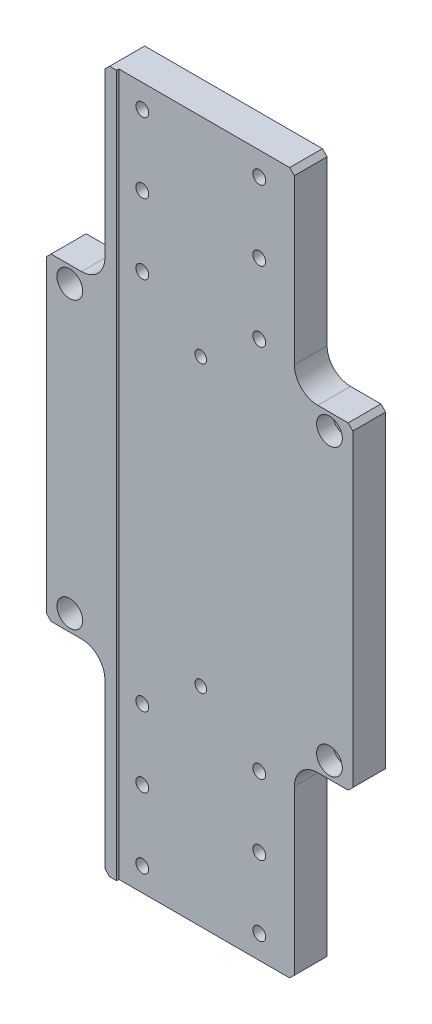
SolidWorks part; units mm, degrees
ref_plane "정면" through (0, 0, 0) normal (0, 0, 1) x (1, 0, 0)
ref_plane "윗면" through (0, 0, 0) normal (0, 1, 0) x (1, 0, 0)
ref_plane "우측면" through (0, 0, 0) normal (1, 0, 0) x (0, 0, -1)
sketch "스케치1" plane through (0, 0, 0) normal (0, 0, 1) x (1, 0, 0)
  line L1 (-65, 68) -> (65, 68)
  line L2 (-65, 68) -> (-65, -68)
  line L3 (-65, -68) -> (65, -68)
  line L4 (65, 68) -> (65, -68)
  line L5 (-40, 150) -> (40, 150)
  line L6 (-40, 150) -> (-40, -150)
  line L7 (-40, -150) -> (40, -150)
  line L8 (40, 150) -> (40, -150)
  line L9 (-40, 150) -> (40, -150) construction
  line L10 (-40, -150) -> (40, 150) construction
  point P4 (0, 0)
  dimension "D1" = 136
  dimension "D2" = 82
  dimension "D3" = 82
  dimension "D4" = 80
  dimension "D5" = 25
  dimension "D6" = 25
extrude "보스-돌출1" add sketch "스케치1" along normal mid plane 15 contours L8 L5 L6 L1 | L6 L1 L2 L3 | L8 L1 L6 L3 | L1 L8 L3 L4 | L8 L3 L6 L7
sketch "스케치2" plane through (0, 0, 7.5) normal (0, 0, 1) x (1, 0, 0)
  line L0 (-40, 150) -> (40, 150) construction
  line L1 (-35, 150) -> (65, 150)
  line L2 (-35, 150) -> (-35, -150)
  line L3 (-35, -150) -> (65, -150)
  line L4 (65, 150) -> (65, -150)
  line L5 (65, 68) -> (65, -68) construction
  line L6 (-40, -150) -> (40, -150) construction
  line L7 (-65, 68) -> (-65, -68) construction
  dimension "D1" = 30
extrude "컷-돌출1" cut sketch "스케치2" against normal blind 1
hole_wizard "Ø5.0mm 맞춤핀 구멍1" positions "스케치3" profile "스케치4" hole size "Ø5.0" standard "ISO"
sketch "스케치3" plane through (0, 0, 6.5) normal (0, 0, 1) x (1, 0, 0)
  line L0 (0, 0) -> (0, 161.072) construction
  line L1 (40, 150) -> (-35, 150) construction
  point P6 (0, 61)
  point P8 (0, -61)
  dimension "D1" = 89
  dimension "D2" = 122
sketch "스케치4" plane through (0, -61, 6.5) normal (1, 0, 0) x (0, -1, 0)
  line L0 (0, 0) -> (0, 14)
  line L1 (0, 14) -> (2.5, 14)
  line L2 (2.5, 14) -> (2.5, 0)
  line L5 (2.5, 0) -> (0, 0)
  line L11 (0, -6.35) -> (0, 107.95) construction
  dimension "관통 구멍 지름" = 5
  dimension "관통 구멍 깊이" = 14
hole_wizard "M5 소켓 머리 캡 나사용 카운터보어1" positions "스케치5" profile "스케치6" counterbore size "M5" standard "KS"
sketch "스케치5" plane through (0, 0, -7.5) normal (0, 0, -1) x (-1, 0, 0)
  line L0 (-40, 150) -> (-40, 68) construction
  line L2 (40, 150) -> (-40, 150) construction
  point P0 (-25, 140)
  point P2 (25, 140)
  point P4 (-25, 110)
  point P6 (25, 110)
  point P8 (-25, 80)
  point P10 (25, 80)
  dimension "D1" = 15
  dimension "D2" = 50
  dimension "D3" = 10
  dimension "D4" = 30
  dimension "D5" = 30
sketch "스케치6" plane through (25, 140, -7.5) normal (1, 0, 0) x (0, 1, 0)
  line L0 (0, 0) -> (0, 15)
  line L1 (0, 15) -> (2.75, 15)
  line L3 (2.75, 15) -> (2.75, 7)
  line L4 (2.75, 7) -> (4.75, 7)
  line L5 (4.75, 7) -> (4.75, 0)
  line L7 (4.75, 0) -> (0, 0)
  line L11 (0, -6.35) -> (0, 107.95) construction
  dimension "관통 구멍 지름" = 5.5
  dimension "관통 구멍 깊이" = 15
  dimension "카운터보어 지름" = 9.5
  dimension "카운터보어 깊이" = 7
pattern_linear "선형 패턴1" count 2 spacing 220 along (0, -1, 0) of "M5 소켓 머리 캡 나사용 카운터보어1"
hole_wizard "M6 소켓 머리 캡 나사용 카운터보어1" positions "스케치7" profile "스케치8" counterbore size "M6" standard "KS"
sketch "스케치7" plane through (0, 0, 7.5) normal (0, 0, 1) x (1, 0, 0)
  line L0 (40, 150) -> (-35, 150) construction
  line L2 (-65, 68) -> (-65, -68) construction
  point P0 (-55, 61)
  point P2 (-55, -61)
  point P4 (55, 61)
  point P6 (55, -61)
  dimension "D1" = 122
  dimension "D2" = 89
  dimension "D3" = 10
  dimension "D4" = 110
sketch "스케치8" plane through (-55, 61, 7.5) normal (1, 0, 0) x (0, -1, 0)
  line L0 (0, 0) -> (0, 15)
  line L1 (0, 15) -> (3.3, 15)
  line L3 (3.3, 15) -> (3.3, 8)
  line L4 (3.3, 8) -> (5.5, 8)
  line L5 (5.5, 8) -> (5.5, 0)
  line L7 (5.5, 0) -> (0, 0)
  line L11 (0, -6.35) -> (0, 107.95) construction
  dimension "관통 구멍 지름" = 6.6
  dimension "관통 구멍 깊이" = 15
  dimension "카운터보어 지름" = 11
  dimension "카운터보어 깊이" = 8
fillet "필렛1" radius 10 4 edges at (-40, 68, 0) (40, 68, -0.5) (40, -68, -0.5) (-40, -68, 0)
chamfer "모따기1" distance 2 angle 45 8 edges at (-40, 150, 0) (-65, 68, 0) (-40, -150, 0) (-65, -68, 0) (40, -150, -0.5) (65, -68, -0.5) (40, 150, -0.5) (65, 68, -0.5)
